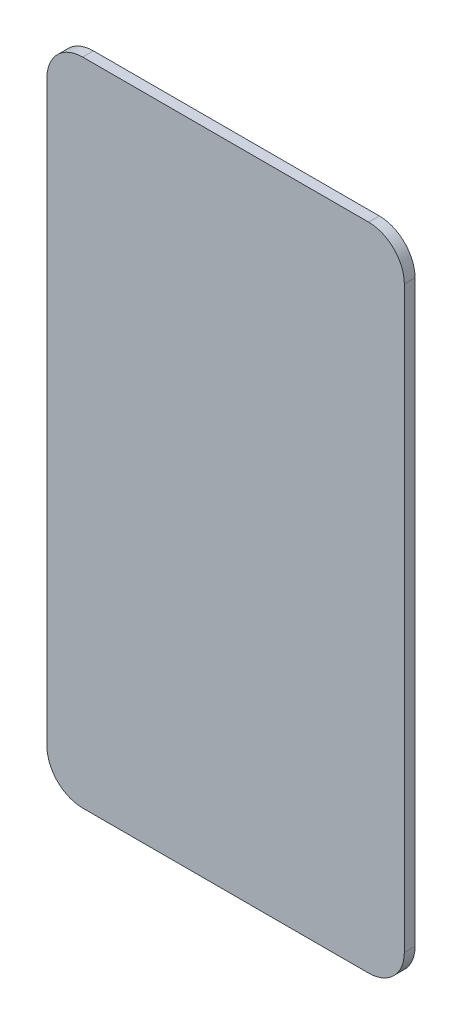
SolidWorks part; units mm, degrees
ref_plane "Plan de face" through (0, 0, 0) normal (0, 0, 1) x (1, 0, 0)
ref_plane "Plan de dessus" through (0, 0, 0) normal (0, 1, 0) x (1, 0, 0)
ref_plane "Plan de droite" through (0, 0, 0) normal (1, 0, 0) x (0, 0, -1)
sketch "Esquisse1" plane through (0, 0, 0) normal (0, 0, 1) x (1, 0, 0)
  line L0 (0, 91) -> (0, -91) construction
  line L1 (-40, 91) -> (40, 91)
  line L2 (-50, 81) -> (-50, -81)
  line L3 (-40, -91) -> (40, -91)
  line L4 (50, 81) -> (50, -81)
  arc A0 (-40, 91) -> (-50, 81) centre (-40, 81) ccw
  arc A1 (50, 81) -> (40, 91) centre (40, 81) ccw
  arc A2 (40, -91) -> (50, -81) centre (40, -81) ccw
  arc A3 (-40, -91) -> (-50, -81) centre (-40, -81) cw
  point P9 (-50, 91)
  point P12 (50, 91)
  point P17 (-50, -91)
  dimension "D3" = 10
  dimension "D1" = 100
  dimension "D2" = 182
extrude "Extrusion1" add sketch "Esquisse1" along normal blind 3
